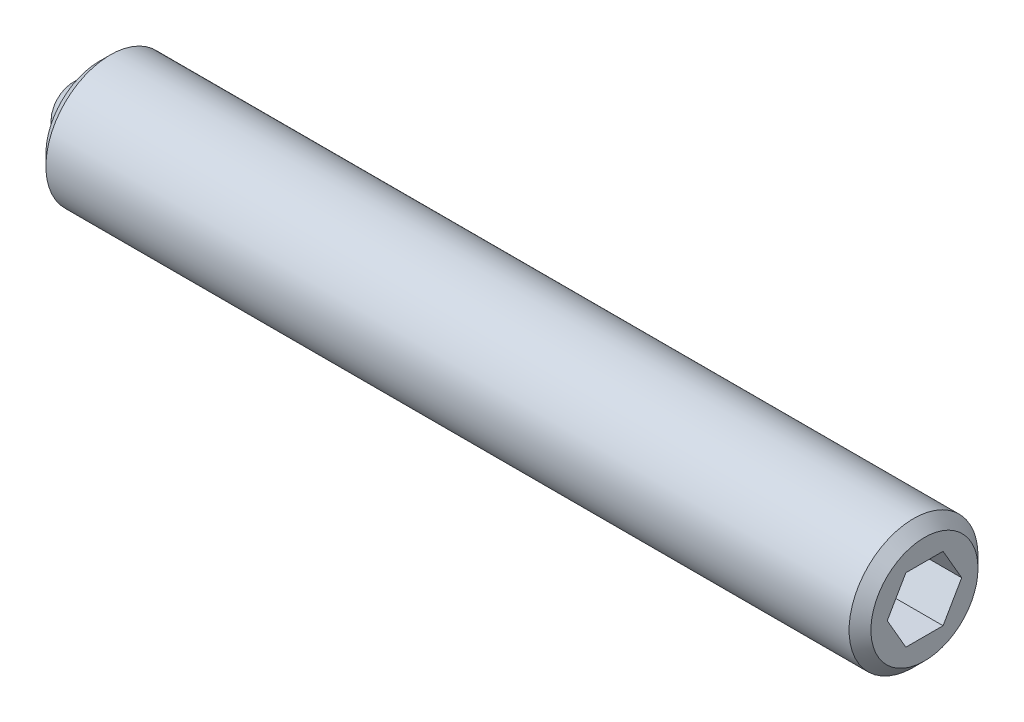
SolidWorks part; units mm, degrees
ref_plane "Front Plane" through (0, 0, 0) normal (0, 0, 1) x (1, 0, 0)
ref_plane "Top Plane" through (0, 0, 0) normal (0, 1, 0) x (1, 0, 0)
ref_plane "Right Plane" through (0, 0, 0) normal (1, 0, 0) x (0, 0, -1)
sketch "Sketch2" plane through (0, 0, 0) normal (1, 0, 0) x (0, 0, -1)
  circle A0 centre (0, 0) radius 1.5
  dimension "D1" = 3
extrude "Boss-Extrude1" add sketch "Sketch2" along normal blind 19.2
sketch "Sketch3" plane through (0, 0, 0) normal (-1, 0, 0) x (0, 0, 1)
  circle A0 centre (0, 0) radius 0.8
  dimension "D1" = 1.6
chamfer "Chamfer1" distance 0.254 angle 45 1 edges at (0, 0, -1.5)
chamfer "Chamfer2" distance 0.254 angle 45 1 edges at (19.2, 0, -1.5)
sketch "Sketch4" plane through (19.2, 0, 0) normal (1, 0, 0) x (0, 0, -1)
  line L1 (0.866, 0) -> (0.433, 0.75)
  line L2 (0.433, 0.75) -> (-0.433, 0.75)
  line L3 (-0.433, 0.75) -> (-0.866, 0)
  line L4 (-0.866, 0) -> (-0.433, -0.75)
  line L5 (-0.433, -0.75) -> (0.433, -0.75)
  line L6 (0.433, -0.75) -> (0.866, 0)
  circle A0 centre (0, 0) radius 0.75 construction
  dimension "D1" = 1.5
extrude "Cut-Extrude2" cut sketch "Sketch4" against normal blind 2
extrude "Cut-Extrude3" cut sketch "Sketch3" against normal blind 0.8
sketch "Sketch5" plane through (0, 0, 0) normal (-1, 0, 0) x (0, 0, 1)
  line L0 (0, 0) -> (0, -0.8)
  line L1 (0, 0) -> (0, 0.8)
  arc A0 (0, 0.8) -> (0, -0.8) centre (0, 0) ccw
  dimension "D1" = 0.8
revolve "Revolve1" add sketch "Sketch5" angle 360 about L1
sketch "Sketch7" plane through (0, 0, 0) normal (-1, 0, 0) x (0, 0, 1)
  line L0 (0, 0) -> (0, 0.8) construction
  arc A0 (0.0634, 0.7975) -> (-0.0634, 0.7975) centre (0, 0) ccw
  arc A1 (0.0634, 0.7975) -> (-0.0634, 0.7975) centre (0, 0.8) ccw
  dimension "D1" = 1.6
  dimension "D2" = 0.127
extrude "Cut-Extrude4" cut sketch "Sketch7" against normal up to surface (0.8 mm away) contours A1 A0
